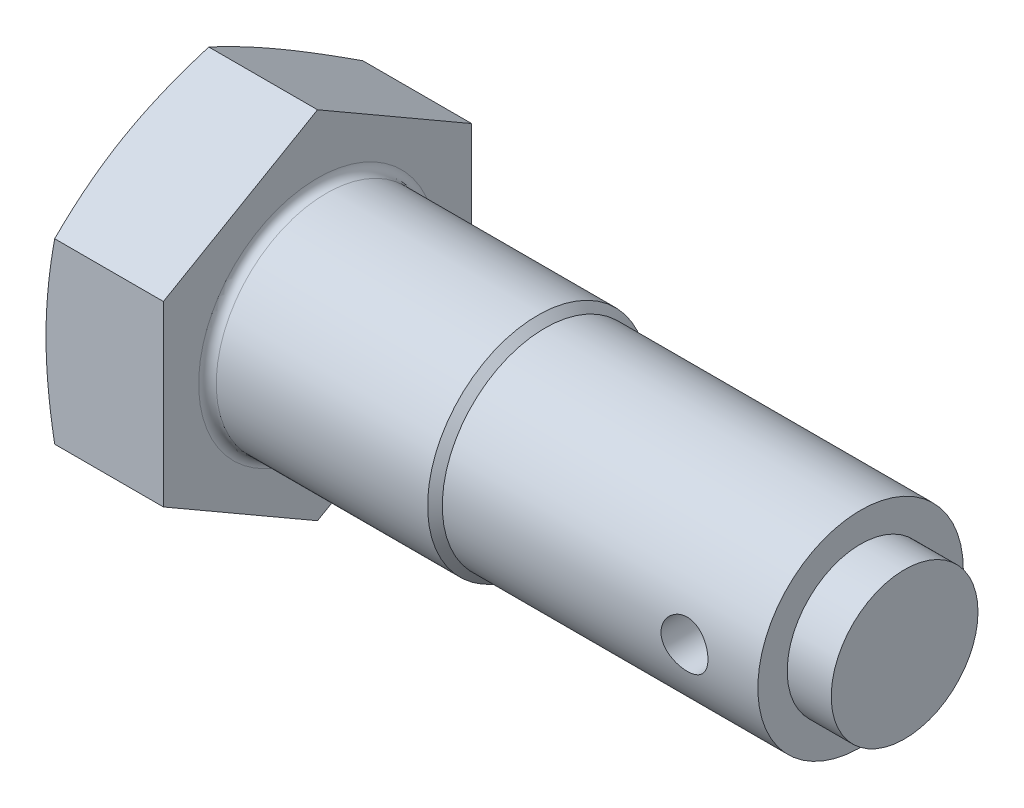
SolidWorks part; units mm, degrees
ref_plane "Front" through (0, 0, 0) normal (0, 0, 1) x (1, 0, 0)
ref_plane "Top" through (0, 0, 0) normal (0, 1, 0) x (1, 0, 0)
ref_plane "Right" through (0, 0, 0) normal (1, 0, 0) x (0, 0, -1)
sketch "Sketch1" plane through (0, 0, 0) normal (1, 0, 0) x (0, 0, -1)
  line L1 (0, -12.1244) -> (10.5, -6.0622)
  line L2 (10.5, -6.0622) -> (10.5, 6.0622)
  line L3 (10.5, 6.0622) -> (0, 12.1244)
  line L4 (0, 12.1244) -> (-10.5, 6.0622)
  line L5 (-10.5, 6.0622) -> (-10.5, -6.0622)
  line L6 (-10.5, -6.0622) -> (0, -12.1244)
  circle A0 centre (0, 0) radius 10.5 construction
  dimension "s" = 21
extrude "BaseHead" add sketch "Sketch1" along normal blind 8
sketch "Sketch2" plane through (8, 0, 0) normal (1, 0, 0) x (0, 0, -1)
  circle A0 centre (0, 0) radius 7.5
  dimension "ds" = 15
extrude "Basebody1" add sketch "Sketch2" along normal blind 15
sketch "Sketch4" plane through (23, 0, 0) normal (1, 0, 0) x (0, 0, -1)
  circle A0 centre (0, 0) radius 7
  dimension "d" = 14
extrude "Basebody2" add sketch "Sketch4" along normal offset from surface (25 mm away) 40
sketch "Sketch5" plane through (48, 0, 0) normal (1, 0, 0) x (0, 0, -1)
  circle A0 centre (0, 0) radius 5
  dimension "dp" = 10
extrude "Cut-Extrude1" cut sketch "Sketch5" against normal blind 3 flip side to cut
sketch "Sketch6" plane through (0, 0, 0) normal (0, 0, 1) x (1, 0, 0)
  line L0 (0, 12.1244) -> (0.5912, 12.1244)
  line L1 (0.5912, 12.1244) -> (0, 10.5)
  line L3 (0, 10.5) -> (0, 12.1244)
  line L4 (-1.5773, 0) -> (3.1205, 0) construction
  line L6 (8, 12.1244) -> (0, 12.1244) construction
  dimension "D1" = 20
  dimension "D2" = 21
revolve "HeadChamfer" cut sketch "Sketch6" angle 360 about L4
fillet "HeadFillet" radius 0.6 1 edges at (8, 0, -7.5)
chamfer "Chamfer1" distance 0.5 angle 45 1 edges at (23, 0, -7)
sketch "Sketch7" plane through (0, 0, 0) normal (0, 0, 1) x (1, 0, 0)
  line L1 (8, 12.1244) -> (8, 6.0622) construction
  line L4 (45, 0) -> (23.5, 0) construction
  circle A0 centre (40, 0) radius 1.6
  dimension "d1" = 3.2
  dimension "lh" = 32
extrude "Hole" cut sketch "Sketch7" against normal through all and the other way through all
equation "\"D1@Chamfer1\" =  ( \"ds@Sketch2\" - \"d@Sketch4\" )  / 2"
equation "\"D2@Sketch6\" = \"s@Sketch1\""
